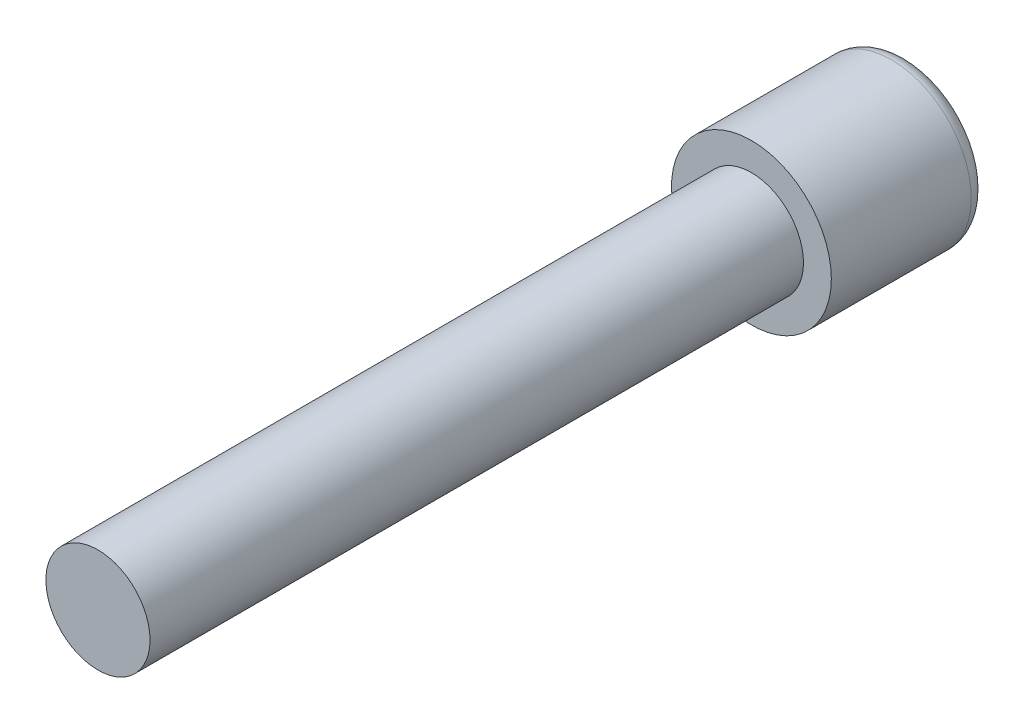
SolidWorks part; units mm, degrees
other "NONE"
ref_plane "Front Plane" through (0, 0, 0) normal (0, 0, 1) x (1, 0, 0)
ref_plane "Top Plane" through (0, 0, 0) normal (0, 1, 0) x (1, 0, 0)
ref_plane "Right Plane" through (0, 0, 0) normal (1, 0, 0) x (0, 0, -1)
imported_body "BOLT SCREW"
sketch "Sketch1" plane through (0, 0, -33.528) normal (0, 0, 1) x (1, 0, 0)
  circle A0 centre (0, 0) radius 2.7051
  circle A1 centre (0, 0) radius 3.8989
  circle A2 centre (0, 0) radius 3.8989
  dimension "D1" = 0
extrude "Cut-Extrude2" cut sketch "Sketch1" against normal blind 3.81
sketch "Sketch2" plane through (0, 0, 0) normal (0, 0, 1) x (1, 0, 0)
  circle A0 centre (0, 0) radius 6.3054
extrude "Cut-Extrude3" cut sketch "Sketch2" against normal blind 15.748
sketch "Sketch3" plane through (0, 0, -15.748) normal (0, 0, 1) x (1, 0, 0)
  circle A1 centre (0, 0) radius 2.7051
  circle A2 centre (0, 0) radius 2.7051
  dimension "D1" = 0
extrude "Boss-Extrude1" add sketch "Sketch3" along normal blind 25.4
sketch "Sketch4" plane through (0, 0, 9.652) normal (0, 0, 1) x (1, 0, 0)
  circle A0 centre (0, 0) radius 2.7051
  circle A1 centre (0, 0) radius 2.54
extrude "Cut-Extrude4" cut sketch "Sketch4" against normal up to surface (46.99 mm away)
sketch "Sketch5" plane through (0, 0, 9.652) normal (0, 0, 1) x (1, 0, 0)
  circle A1 centre (0, 0) radius 2.54
  circle A2 centre (0, 0) radius 2.54
  dimension "D1" = 0
extrude "Cut-Extrude5" cut sketch "Sketch5" against normal blind 15.113
